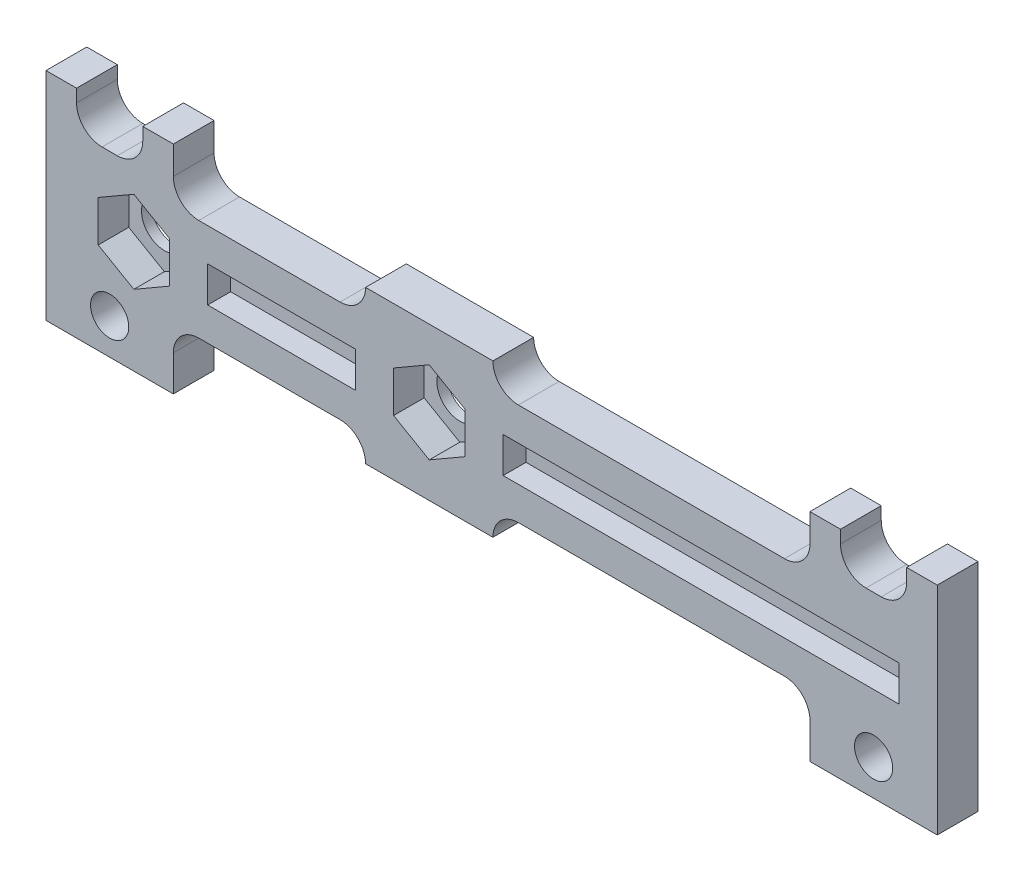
SolidWorks part; units mm, degrees
ref_plane "Front Plane" through (0, 0, 0) normal (0, 0, 1) x (1, 0, 0)
ref_plane "Top Plane" through (0, 0, 0) normal (0, 1, 0) x (1, 0, 0)
ref_plane "Right Plane" through (0, 0, 0) normal (1, 0, 0) x (0, 0, -1)
sketch "Sketch1" plane through (0, 0, 0) normal (0, 0, 1) x (1, 0, 0)
  line L1 (-4.2672, 4.4612) -> (5.7328, 4.4612)
  line L2 (-4.2672, 4.4612) -> (-4.2672, -12.5388)
  line L3 (-4.2672, -12.5388) -> (5.7328, -12.5388)
  line L4 (5.7328, 4.4612) -> (5.7328, -12.5388)
  dimension "D1" = 17
  dimension "D2" = 10
extrude "Boss-Extrude1" add sketch "Sketch1" along normal blind 3.2
sketch "Sketch3" plane through (0, 0, 0) normal (0, 0, 1) x (1, 0, 0)
  line L0 (-4.2672, -12.5388) -> (5.7328, -12.5388) construction
  circle A0 centre (0.7328, -9.7388) radius 1.5
  point P6 (0.7328, -12.5388)
  dimension "D1" = 3
  dimension "D2" = 2.8
extrude "Cut-Extrude3" cut sketch "Sketch3" along normal blind 5.4
ref_plane "Plane1" through (0, 0, 3.2) normal (0, 0, 1) x (1, 0, 0)
sketch "Sketch4" plane through (0, 0, 3.2) normal (0, 0, 1) x (1, 0, 0)
  circle A0 centre (0.7328, -9.7388) radius 2.1
  dimension "D1" = 4.2
sketch "Sketch11" plane through (0, 0, 0) normal (0, 0, 1) x (1, 0, 0)
  line L0 (-4.2672, 4.4612) -> (-4.2672, -12.5388) construction
  line L1 (-4.2672, -12.5388) -> (5.7328, -12.5388) construction
  circle A0 centre (2.6328, -3.7388) radius 1.8
  dimension "D1" = 3.6
  dimension "D2" = 6.9
  dimension "D3" = 8.8
extrude "Cut-Extrude6" cut sketch "Sketch11" along normal up to surface (3.2 mm away)
sketch "Sketch12" plane through (0, 0, 0) normal (0, 0, 1) x (1, 0, 0)
  line L0 (5.7328, -12.5388) -> (5.7328, 4.4612) construction
  line L1 (5.7328, 0.2612) -> (65.7328, 0.2612)
  line L2 (5.7328, 0.2612) -> (5.7328, -7.7388)
  line L3 (5.7328, -7.7388) -> (65.7328, -7.7388)
  line L4 (65.7328, 0.2612) -> (65.7328, -7.7388)
  circle A1 centre (2.6328, -3.7388) radius 1.8 construction
  dimension "D1" = 4
  dimension "D2" = 4
  dimension "D3" = 60
extrude "Boss-Extrude2" add sketch "Sketch12" along normal up to surface (3.2 mm away)
sketch "Sketch13" plane through (0, 0, 0) normal (0, 0, 1) x (1, 0, 0)
  line L0 (65.7328, -7.7388) -> (65.7328, 0.2612) construction
  line L1 (55.7328, -12.5388) -> (65.7328, -12.5388)
  line L2 (55.7328, -12.5388) -> (55.7328, 4.4612)
  line L3 (55.7328, 4.4612) -> (65.7328, 4.4612)
  line L4 (65.7328, -12.5388) -> (65.7328, 4.4612)
  line L5 (5.7328, 4.4612) -> (-4.2672, 4.4612) construction
  line L6 (-4.2672, -12.5388) -> (5.7328, -12.5388) construction
  circle A0 centre (60.7328, -9.7388) radius 1.5
  dimension "D2" = 3
  dimension "D1" = 10
  dimension "D3" = 5
  dimension "D4" = 2.8
extrude "Boss-Extrude3" add sketch "Sketch13" along normal up to surface (3.2 mm away)
sketch "Sketch7" plane through (0, 0, 0) normal (0, 0, 1) x (1, 0, 0)
  line L0 (5.7328, 4.4612) -> (-4.2672, 4.4612) construction
  line L1 (3.3328, 4.4612) -> (-1.8672, 4.4612)
  line L2 (3.3328, 4.4612) -> (3.3328, 1.4612)
  line L3 (3.3328, 1.4612) -> (-1.8672, 1.4612)
  line L4 (-1.8672, 4.4612) -> (-1.8672, 1.4612)
  line L5 (5.7328, -12.5388) -> (5.7328, -7.7388) construction
  line L6 (-4.2672, 4.4612) -> (-4.2672, -12.5388) construction
  line L7 (65.7328, 4.4612) -> (55.7328, 4.4612) construction
  line L8 (58.1328, 4.4612) -> (63.3328, 4.4612)
  line L9 (58.1328, 4.4612) -> (58.1328, 1.4612)
  line L10 (58.1328, 1.4612) -> (63.3328, 1.4612)
  line L11 (63.3328, 4.4612) -> (63.3328, 1.4612)
  line L12 (55.7328, 4.4612) -> (55.7328, 0.2612) construction
  line L13 (65.7328, -12.5388) -> (65.7328, 4.4612) construction
  dimension "D1" = 2.4
  dimension "D2" = 2.4
  dimension "D3" = 3
  dimension "D4" = 2.4
  dimension "D5" = 3
  dimension "D6" = 2.4
extrude "Cut-Extrude7" cut sketch "Sketch7" along normal up to surface (3.2 mm away)
fillet "Fillet1" radius 2 8 edges at (55.7328, -7.7388, 1.6) (5.7328, -7.7388, 1.6) (5.7328, 0.2612, 1.6) (55.7328, 0.2612, 1.6) (63.3328, 1.4612, 1.6) (58.1328, 1.4612, 1.6) (3.3328, 1.4612, 1.6) (-1.8672, 1.4612, 1.6)
sketch "Sketch14" plane through (0, 0, 0) normal (0, 0, 1) x (1, 0, 0)
  line L0 (7.7328, -7.7388) -> (53.7328, -7.7388) construction
  circle A0 centre (25.8328, -3.7388) radius 1.8
  dimension "D1" = 23.2
  dimension "D2" = 3.6
  dimension "D3" = 4
extrude "Cut-Extrude8" cut sketch "Sketch14" along normal up to surface (3.2 mm away)
sketch "Sketch15" plane through (0, 0, 0) normal (0, 0, 1) x (1, 0, 0)
  line L0 (53.7328, 0.2612) -> (7.7328, 0.2612) construction
  line L1 (30.8328, 0.2612) -> (20.8328, 0.2612)
  line L2 (30.8328, 0.2612) -> (30.8328, 2.2612)
  line L3 (30.8328, 2.2612) -> (20.8328, 2.2612)
  line L4 (20.8328, 0.2612) -> (20.8328, 2.2612)
  line L5 (7.7328, -7.7388) -> (53.7328, -7.7388) construction
  line L6 (30.8328, -7.7388) -> (20.8328, -7.7388)
  line L7 (30.8328, -7.7388) -> (30.8328, -9.7388)
  line L8 (30.8328, -9.7388) -> (20.8328, -9.7388)
  line L9 (20.8328, -7.7388) -> (20.8328, -9.7388)
  circle A0 centre (25.8328, -3.7388) radius 1.8 construction
  dimension "D1" = 5
  dimension "D2" = 5
  dimension "D3" = 2
  dimension "D4" = 2
extrude "Boss-Extrude4" add sketch "Sketch15" along normal up to surface (3.2 mm away)
fillet "Fillet2" radius 2 4 edges at (20.8328, -7.7388, 1.6) (30.8328, -7.7388, 1.6) (20.8328, 0.2612, 1.6) (30.8328, 0.2612, 1.6)
ref_plane "Plane2" through (0, 0, 0) normal (0, 0, -1) x (-1, 0, 0)
ref_plane "Plane3" through (0, 0, 0) normal (0, 0, -1) x (-1, 0, 0)
hole_wizard "CSK for M2.5 Flat Head Machine Screw1" positions "Sketch18" profile "Sketch19" countersink size "M2.5" standard "ANSI Metric"
sketch "Sketch18" plane through (0, 0, 0) normal (0, 0, -1) x (-1, 0, 0)
  point P0 (-0.7328, -9.7388)
  point P3 (-60.7328, -9.7388)
sketch "Sketch19" plane through (0.7328, -9.7388, 0) normal (1, 0, 0) x (0, 1, 0)
  line L0 (0, 0) -> (0, 14.9013)
  line L1 (0, 14.9013) -> (1.5, 14)
  line L2 (1.5, 14) -> (1.5, 0.8)
  line L3 (1.5, 0.8) -> (2.3, 0)
  line L5 (2.3, 0) -> (0, 0)
  line L6 (-1.5, 0.8) -> (-2.3, 0) construction
  line L10 (0, 14.9013) -> (-1.5, 14) construction
  line L11 (0, -6.35) -> (0, 107.95) construction
  dimension "Hole Dia." = 3
  dimension "Hole Depth" = 14
  dimension "Near C'Sink Dia." = 4.6
  dimension "Near C'Sink Angle" = 90
  dimension "Drill Angle" = 118
sketch "Sketch20" plane through (0, 0, 3.2) normal (0, 0, 1) x (1, 0, 0)
  line L1 (2.6328, -6.972) -> (5.4328, -5.3554)
  line L2 (5.4328, -5.3554) -> (5.4328, -2.1222)
  line L3 (5.4328, -2.1222) -> (2.6328, -0.5056)
  line L4 (2.6328, -0.5056) -> (-0.1672, -2.1222)
  line L5 (-0.1672, -2.1222) -> (-0.1672, -5.3554)
  line L6 (-0.1672, -5.3554) -> (2.6328, -6.972)
  line L7 (25.8328, -6.972) -> (28.6328, -5.3554)
  line L8 (28.6328, -5.3554) -> (28.6328, -2.1222)
  line L9 (28.6328, -2.1222) -> (25.8328, -0.5056)
  line L10 (25.8328, -0.5056) -> (23.0328, -2.1222)
  line L11 (23.0328, -2.1222) -> (23.0328, -5.3554)
  line L12 (23.0328, -5.3554) -> (25.8328, -6.972)
  circle A0 centre (2.6328, -3.7388) radius 2.8 construction
  circle A1 centre (25.8328, -3.7388) radius 2.8 construction
  dimension "D1" = 5.6
  dimension "D2" = 5.6
extrude "Cut-Extrude11" cut sketch "Sketch20" against normal blind 2.4
sketch "Sketch21" plane through (0, 0, 3.2) normal (0, 0, 1) x (1, 0, 0)
  line L0 (65.7328, -12.5388) -> (65.7328, 4.4612) construction
  line L1 (8.4328, -2.3388) -> (20.0328, -2.3388)
  line L2 (8.4328, -2.3388) -> (8.4328, -5.1388)
  line L3 (8.4328, -5.1388) -> (20.0328, -5.1388)
  line L4 (20.0328, -2.3388) -> (20.0328, -5.1388)
  line L5 (31.6328, -2.3388) -> (62.7328, -2.3388)
  line L6 (31.6328, -2.3388) -> (31.6328, -5.1388)
  line L7 (31.6328, -5.1388) -> (62.7328, -5.1388)
  line L8 (62.7328, -2.3388) -> (62.7328, -5.1388)
  line L9 (32.8328, -7.7388) -> (53.7328, -7.7388) construction
  line L10 (28.6328, -5.3554) -> (28.6328, -2.1222) construction
  line L11 (53.7328, 0.2612) -> (32.8328, 0.2612) construction
  line L12 (5.4328, -5.3554) -> (5.4328, -2.1222) construction
  line L13 (23.0328, -2.1222) -> (23.0328, -5.3554) construction
  dimension "D1" = 3
  dimension "D2" = 2.6
  dimension "D3" = 3
  dimension "D4" = 2.6
  dimension "D5" = 3
  dimension "D6" = 3
extrude "Cut-Extrude12" cut sketch "Sketch21" against normal blind 1.8
sketch "Sketch22" plane through (0, 0, 0) normal (0, 0, 1) x (1, 0, 0)
  line L0 (61.7328, -5.7388) -> (53.6882, -5.7388) construction
  line L1 (32.8328, -7.7388) -> (53.7328, -7.7388) construction
  line L2 (65.7328, -12.5388) -> (65.7328, 4.4612) construction
  text T0 "L" font "Century Gothic" height in points 20
  point P7 (65.7328, -4.0388)
  dimension "D1" = 2
  dimension "D2" = 4
extrude "Cut-Extrude13" cut sketch "Sketch22" along normal blind 0.4
